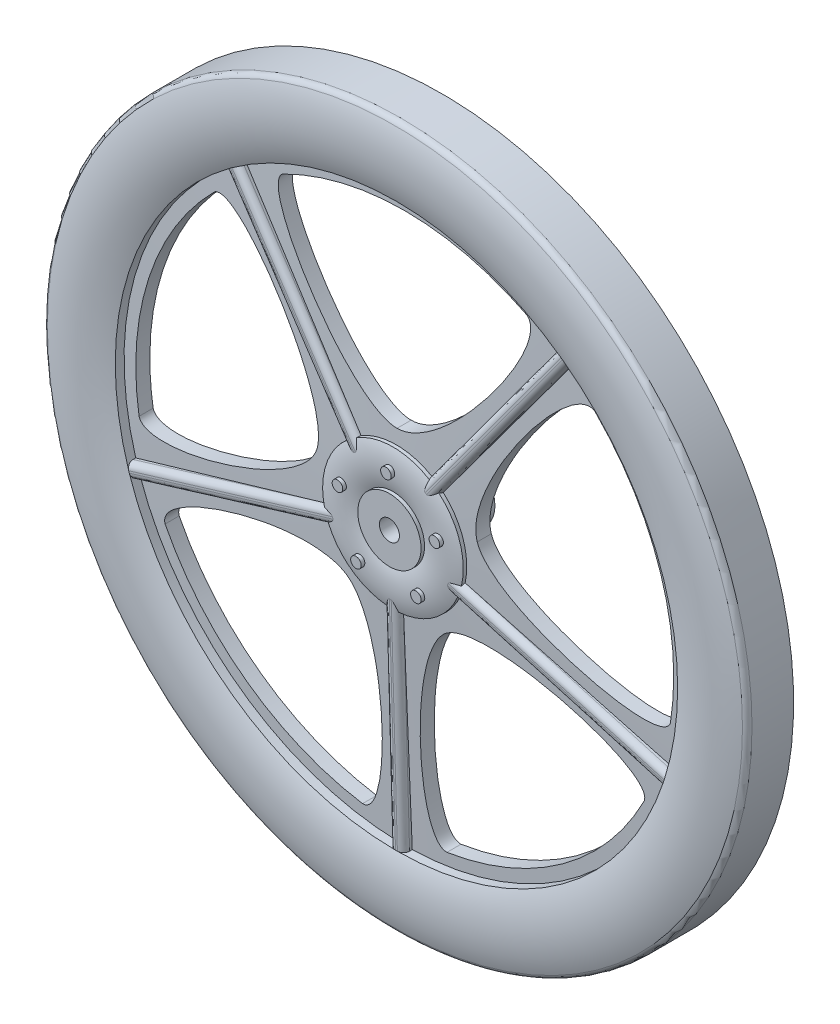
SolidWorks part; units mm, degrees
ref_plane "Plan de face" through (0, 0, 0) normal (0, 0, 1) x (1, 0, 0)
ref_plane "Plan de dessus" through (0, 0, 0) normal (0, 1, 0) x (1, 0, 0)
ref_plane "Plan de droite" through (0, 0, 0) normal (1, 0, 0) x (0, 0, -1)
sketch "Esquisse1" plane through (0, 0, 0) normal (0, 1, 0) x (1, 0, 0)
  line L0 (-9.5432, 0) -> (53.1323, 0) construction
  line L1 (0, 19.7061) -> (0, -20.2019) construction
  line L2 (50, 40.032) -> (50, -8.5517) construction
  line L3 (-12.8761, 10.5) -> (53.1323, 10.5) construction
  line L4 (1.425, 10.8829) -> (1.425, -18.494) construction
  line L5 (4.5, 10.8829) -> (4.5, -18.494) construction
  line L6 (3.1787, 0.5) -> (17.981, 0.5) construction
  line L7 (37.2638, 7.5) -> (65.4001, 7.5) construction
  line L8 (38.1037, 1) -> (66.135, 1) construction
  line L9 (40, 10.5) -> (40, -13.9545) construction
  line L10 (10, 3.3316) -> (10, -9.1026) construction
  line L11 (50, 7.5) -> (50, 1)
  line L12 (35.6933, 2.25) -> (45.6989, 2.25) construction
  line L13 (40, 1) -> (40, 2.25)
  line L14 (3.1787, 1) -> (16.0713, 1) construction
  line L15 (10, 0.5) -> (10, 1)
  line L16 (10, 1) -> (40, 2.25)
  line L17 (4.5, 0.5) -> (4.5, 0)
  line L18 (4.5, 0) -> (1.425, 0)
  line L19 (8, 2.0486) -> (8, 2.9184)
  line L20 (8, 2.9184) -> (42, 4.3351)
  line L21 (42, 2.417) -> (42, 4.3351)
  line L22 (48, 7.5) -> (48, 2.417)
  line L23 (2.5, 4.4626) -> (2.5, 0) construction
  line L24 (1.425, 0) -> (1.425, 10.5)
  line L25 (1.425, 10.5) -> (4.5, 10.5)
  line L26 (4.5, 10.5) -> (4.5, 2.6917)
  line L27 (48, 7.5) -> (50, 7.5)
  arc A0 (40, 1) -> (50, 1) centre (45, 13) ccw
  arc A1 (4.5, 0.5) -> (10, 0.5) centre (7.25, 7.8124) ccw
  arc A2 (4.5, 2.6917) -> (8, 2.0486) centre (7.25, 7.8124) ccw
  arc A3 (42, 2.417) -> (48, 2.417) centre (45, 13) ccw
  arc A4 (2.5, 4.4626) -> (8, 2.0486) centre (7.25, 7.8124) ccw construction
  dimension "D1" = 2
revolve "Révolution1" add sketch "Esquisse1" angle 360 about L1
sketch "Esquisse2" plane through (0, 0, 0) normal (0, 0, 1) x (1, 0, 0)
  line L0 (0, 0) -> (70.2258, 0) construction
  line L1 (70.2258, 0) -> (0, 0) construction
  line L2 (0, 0) -> (37.7738, 51.9912) construction
  line L3 (0, 0) -> (-43.3396, 59.6518) construction
  line L4 (-4.8541, 3.5267) -> (32.9197, 55.5179) construction
  line L5 (4.8541, 3.5267) -> (-38.4855, 63.1786) construction
  line L6 (0, 0) -> (0, 53.8968) construction
  line L7 (-10.907, 12) -> (26.5978, 12) construction
  arc A0 (17.3576, 34.0986) -> (-17.3576, 34.0986) centre (0, 0) ccw
  arc A1 (-27.0659, 27.0451) -> (-37.7935, -5.9711) centre (0, 0) ccw
  arc A2 (-34.0853, -17.3837) -> (-6, -37.7889) centre (0, 0) ccw
  arc A3 (6, -37.7889) -> (34.0853, -17.3837) centre (0, 0) ccw
  arc A4 (37.7935, -5.9711) -> (27.0659, 27.0451) centre (0, 0) ccw
  spline S0 degree 3 poles (-17.3576, 34.0986) (-21.0036, 31.4941) (-6.8819, 11.9467) (0, 11.9996) knots 0 0 0 0 0.949313 0.949313 0.949313 0.949313
  spline S1 degree 3 poles (17.3576, 34.0986) (21.0036, 31.4941) (6.8819, 11.9467) (0, 11.9996) knots 0 0 0 0 0.949313 0.949313 0.949313 0.949313
  spline S2 degree 3 poles (-27.0659, 27.0451) (-23.4622, 29.7078) (-9.2353, 10.2368) (-11.4123, 3.7081) knots 0 0 0 0 0.949313 0.949313 0.949313 0.949313
  spline S3 degree 3 poles (-37.7935, -5.9711) (-36.4431, -10.2434) (-13.4886, -2.8534) (-11.4123, 3.7081) knots 0 0 0 0 0.949313 0.949313 0.949313 0.949313
  spline S4 degree 3 poles (-34.0853, -17.3837) (-35.504, -13.1337) (-12.5897, -5.6199) (-7.0532, -9.7079) knots 0 0 0 0 0.949313 0.949313 0.949313 0.949313
  spline S5 degree 3 poles (-6, -37.7889) (-1.5195, -37.8249) (-1.4545, -13.7102) (-7.0532, -9.7079) knots 0 0 0 0 0.949313 0.949313 0.949313 0.949313
  spline S6 degree 3 poles (6, -37.7889) (1.5195, -37.8249) (1.4545, -13.7102) (7.0532, -9.7079) knots 0 0 0 0 0.949313 0.949313 0.949313 0.949313
  spline S7 degree 3 poles (34.0853, -17.3837) (35.504, -13.1337) (12.5897, -5.6199) (7.0532, -9.7079) knots 0 0 0 0 0.949313 0.949313 0.949313 0.949313
  spline S8 degree 3 poles (37.7935, -5.9711) (36.4431, -10.2434) (13.4886, -2.8534) (11.4123, 3.7081) knots 0 0 0 0 0.949313 0.949313 0.949313 0.949313
  spline S9 degree 3 poles (27.0659, 27.0451) (23.4622, 29.7078) (9.2353, 10.2368) (11.4123, 3.7081) knots 0 0 0 0 0.949313 0.949313 0.949313 0.949313
  dimension "D1" = 54
  dimension "D2" = 54
  dimension "D4" = 6
extrude "Enlèv. mat.-Extru.1" cut sketch "Esquisse2" against normal through all
sketch "Esquisse3" plane through (0, 0, 0) normal (0, 0, 1) x (1, 0, 0)
  circle A0 centre (0, 0) radius 7.25 construction
  circle A1 centre (0, 7.25) radius 0.75
  circle A2 centre (-6.8952, 2.2404) radius 0.75
  circle A3 centre (-4.2614, -5.8654) radius 0.75
  circle A4 centre (4.2614, -5.8654) radius 0.75
  circle A5 centre (6.8952, 2.2404) radius 0.75
extrude "Extrusion1" add sketch "Esquisse3" along normal mid plane 1
sketch "Esquisse5" plane through (0, 0, 0) normal (1, 0, 0) x (0, 0, -1)
  line L0 (1, -7.8434) -> (2.25, -40.0047) construction
  line L1 (1, 10) -> (1, -10) construction
  line L2 (2.25, -40) -> (2.25, 40) construction
  line L3 (0.0662, -6.7122) -> (1, -40.0502)
  line L4 (1, -40.0502) -> (2.3036, -40.0047)
  line L5 (2.3036, -40.0047) -> (1.1546, -6.7122)
  line L6 (1.1546, -6.7122) -> (0.0662, -6.7122)
  line L7 (1, 50) -> (1, -50) construction
extrude "Extrusion2" add sketch "Esquisse5" along normal mid plane 2
fillet "Congé variable2" radius 0.866 12 edges at (-1, -24.2662, -0.5579) (1, -24.2662, -0.5579) (-1, 8.99, -15.4157) (-1, -9.9499, -0.75) (1, 8.99, -15.4157) (1, -9.9499, -0.75)
pattern_circular "Répétition circulaire1" count 5 every 72 about axis through (0, 0, -19.7061) along (0, 0, 1) of "Extrusion2", "Congé variable2"
fillet "Congé1" radius 0.85 1 edges at (-50, 0, -1)
